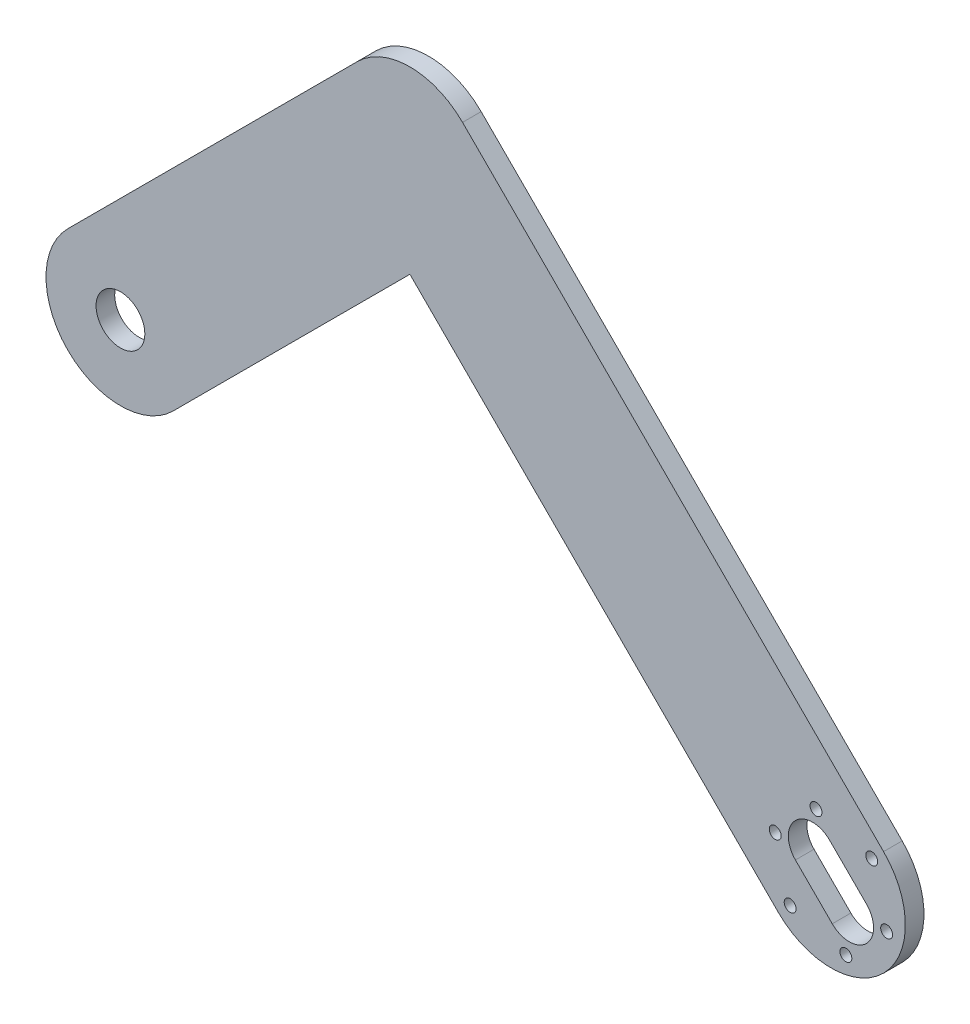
SolidWorks part; units mm, degrees
ref_plane "前视基准面" through (0, 0, 0) normal (0, 0, 1) x (1, 0, 0)
ref_plane "上视基准面" through (0, 0, 0) normal (0, 1, 0) x (1, 0, 0)
ref_plane "右视基准面" through (0, 0, 0) normal (1, 0, 0) x (0, 0, -1)
other "Configuration Table"
sketch "草图1" plane through (0, 0, 0) normal (0, 0, 1) x (1, 0, 0)
  line L0 (-14.1421, 14.1421) -> (63.6396, 91.9239)
  line L1 (14.1421, -14.1421) -> (91.9239, 63.6396)
  line L2 (0, 0) -> (77.7817, 77.7817)
  line L3 (63.6396, 63.6396) -> (176.7767, -49.4975)
  line L12 (91.9239, 91.9239) -> (205.061, -21.2132)
  line L13 (77.7817, 77.7817) -> (190.9188, -35.3553)
  circle A0 centre (0, 0) radius 20
  circle A1 centre (77.7817, 77.7817) radius 20
  circle A2 centre (190.9188, -35.3553) radius 20
  arc A9 (14.1421, 14.1421) -> (-14.1421, 14.1421) centre (0, 0) ccw
  point P1 (0, 0)
  point P2 (163.2799, -45.3618)
  point P3 (175.0897, -26.121)
  point P7 (179.4339, -23.8704)
  point P25 (0, 0)
  dimension "D2" = 40
  dimension "D5" = 40
  dimension "D6" = 40
  dimension "D7" = 40
  dimension "D3" = 45
  dimension "D4" = 90
  dimension "D1" = 110
  dimension "D8" = 160
extrude "凸台-拉伸1" add sketch "草图1" along normal blind 5
sketch "草图2" plane through (0, 0, 5) normal (0, 0, 1) x (1, 0, 0)
  line L0 (190.5653, -25.8094) -> (200.4648, -35.7089) construction
  line L1 (191.2724, -44.9013) -> (181.3729, -35.0018) construction
  line L2 (190.5653, -25.8094) -> (200.4648, -35.7089)
  line L3 (191.2724, -44.9013) -> (181.3729, -35.0018)
  arc A0 (191.2724, -44.9013) -> (200.4648, -35.7089) centre (195.8686, -40.3051) ccw construction
  arc A1 (190.5653, -25.8094) -> (181.3729, -35.0018) centre (185.9691, -30.4056) ccw construction
  arc A2 (174.8156, -32.475) -> (177.0784, -30.2123) centre (175.947, -31.3436) ccw construction
  arc A3 (177.0784, -30.2123) -> (174.8156, -32.475) centre (175.947, -31.3436) ccw construction
  arc A4 (178.8273, -47.4469) -> (181.09, -45.1841) centre (179.9587, -46.3155) ccw construction
  arc A5 (181.09, -45.1841) -> (178.8273, -47.4469) centre (179.9587, -46.3155) ccw construction
  arc A6 (193.7992, -51.4586) -> (196.0619, -49.1958) centre (194.9305, -50.3272) ccw construction
  arc A7 (196.0619, -49.1958) -> (193.7992, -51.4586) centre (194.9305, -50.3272) ccw construction
  arc A8 (204.7593, -40.4984) -> (207.0221, -38.2357) centre (205.8907, -39.367) ccw construction
  arc A9 (207.0221, -38.2357) -> (204.7593, -40.4984) centre (205.8907, -39.367) ccw construction
  arc A10 (200.7476, -25.5266) -> (203.0104, -23.2638) centre (201.879, -24.3952) ccw construction
  arc A11 (203.0104, -23.2638) -> (200.7476, -25.5266) centre (201.879, -24.3952) ccw construction
  arc A12 (185.7758, -21.5149) -> (188.0385, -19.2521) centre (186.9071, -20.3835) ccw construction
  arc A13 (188.0385, -19.2521) -> (185.7758, -21.5149) centre (186.9071, -20.3835) ccw construction
  arc A14 (191.2724, -44.9013) -> (200.4648, -35.7089) centre (195.8686, -40.3051) ccw
  arc A15 (190.5653, -25.8094) -> (181.3729, -35.0018) centre (185.9691, -30.4056) ccw
  arc A16 (174.8156, -32.475) -> (177.0784, -30.2123) centre (175.947, -31.3436) ccw
  arc A17 (177.0784, -30.2123) -> (174.8156, -32.475) centre (175.947, -31.3436) ccw
  arc A18 (178.8273, -47.4469) -> (181.09, -45.1841) centre (179.9587, -46.3155) ccw
  arc A19 (181.09, -45.1841) -> (178.8273, -47.4469) centre (179.9587, -46.3155) ccw
  arc A20 (193.7992, -51.4586) -> (196.0619, -49.1958) centre (194.9305, -50.3272) ccw
  arc A21 (196.0619, -49.1958) -> (193.7992, -51.4586) centre (194.9305, -50.3272) ccw
  arc A22 (204.7593, -40.4984) -> (207.0221, -38.2357) centre (205.8907, -39.367) ccw
  arc A23 (207.0221, -38.2357) -> (204.7593, -40.4984) centre (205.8907, -39.367) ccw
  arc A24 (200.7476, -25.5266) -> (203.0104, -23.2638) centre (201.879, -24.3952) ccw
  arc A25 (203.0104, -23.2638) -> (200.7476, -25.5266) centre (201.879, -24.3952) ccw
  arc A26 (185.7758, -21.5149) -> (188.0385, -19.2521) centre (186.9071, -20.3835) ccw
  arc A27 (188.0385, -19.2521) -> (185.7758, -21.5149) centre (186.9071, -20.3835) ccw
extrude "切除-拉伸1" cut sketch "草图2" against normal blind 10
sketch "草图3" plane through (0, 0, 0) normal (0, 0, -1) x (-1, 0, 0)
  circle A0 centre (0, 0) radius 6.55
  dimension "D1" = 13.1
extrude "切除-拉伸2" cut sketch "草图3" against normal blind 6
